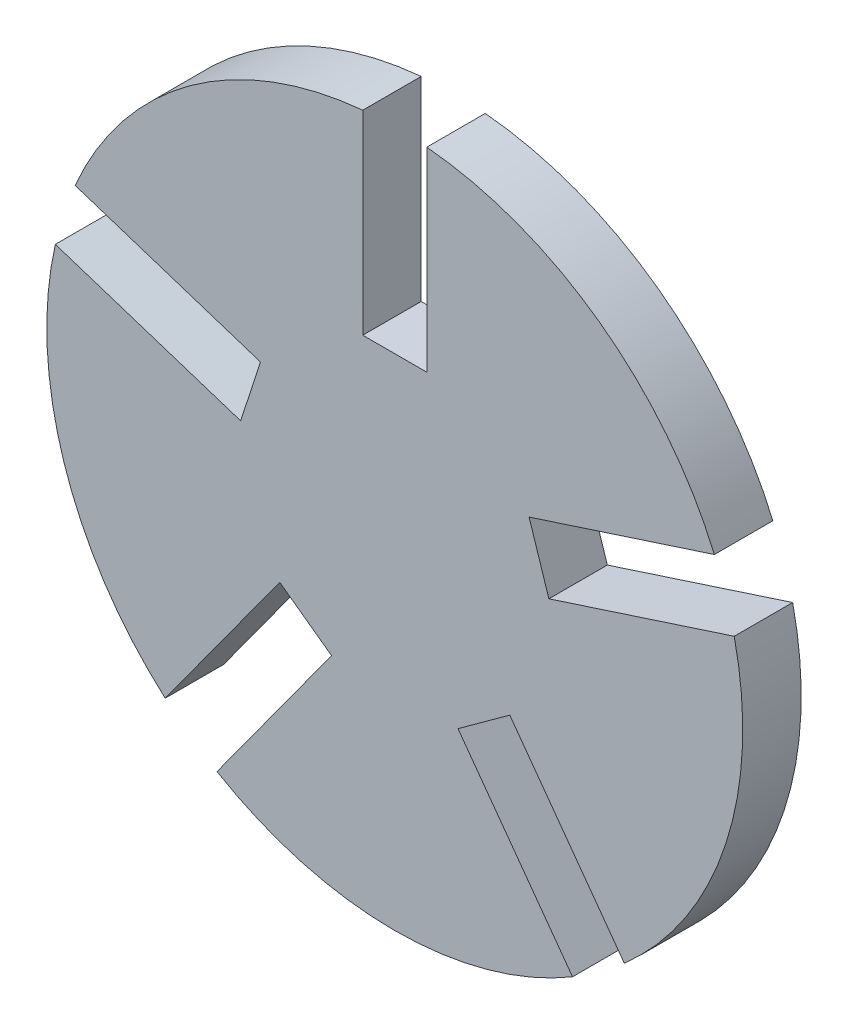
SolidWorks part; units mm, degrees
ref_plane "Front Plane" through (0, 0, 0) normal (0, 0, 1) x (1, 0, 0)
ref_plane "Top Plane" through (0, 0, 0) normal (0, 1, 0) x (1, 0, 0)
ref_plane "Right Plane" through (0, 0, 0) normal (1, 0, 0) x (0, 0, -1)
sketch "Sketch1" plane through (0, 0, 0) normal (0, 0, 1) x (1, 0, 0)
  line L0 (0, 0) -> (5114.4182, 0) construction
  line L1 (22.9648, 9.8801) -> (9.65, 5.5539)
  line L2 (0, 25.4204) -> (0, 5114.4182) construction
  line L3 (24.3863, 5.5052) -> (11.0715, 1.179)
  line L4 (9.65, 5.5539) -> (11.0715, 1.179)
  line L6 (-2.3, 24.894) -> (-2.3, 10.894)
  line L7 (-2.3, 10.894) -> (2.3, 10.894)
  line L8 (2.3, 24.894) -> (2.3, 10.894)
  line L9 (16.4931, -18.7877) -> (8.2641, -7.4615)
  line L10 (12.7716, -21.4916) -> (4.5426, -10.1653)
  line L11 (8.2641, -7.4615) -> (4.5426, -10.1653)
  line L12 (-12.7716, -21.4916) -> (-4.5426, -10.1653)
  line L13 (-16.4931, -18.7877) -> (-8.2641, -7.4615)
  line L14 (-4.5426, -10.1653) -> (-8.2641, -7.4615)
  line L15 (-24.3863, 5.5052) -> (-11.0715, 1.179)
  line L16 (-22.9648, 9.8801) -> (-9.65, 5.5539)
  line L17 (-11.0715, 1.179) -> (-9.65, 5.5539)
  arc A0 (-2.3, 24.894) -> (-22.9648, 9.8801) centre (0, 0) ccw
  arc A1 (-24.3863, 5.5052) -> (-16.4931, -18.7877) centre (0, 0) ccw
  arc A2 (22.9648, 9.8801) -> (2.3, 24.894) centre (0, 0) ccw
  arc A3 (16.4931, -18.7877) -> (24.3863, 5.5052) centre (0, 0) ccw
  arc A4 (-12.7716, -21.4916) -> (12.7716, -21.4916) centre (0, 0) ccw
  point P29 (0, 0)
  dimension "D1" = 50
  dimension "D2" = 14
  dimension "D3" = 4.6
  dimension "D4" = 5
extrude "Boss-Extrude1" add sketch "Sketch1" along normal mid plane 4.2
